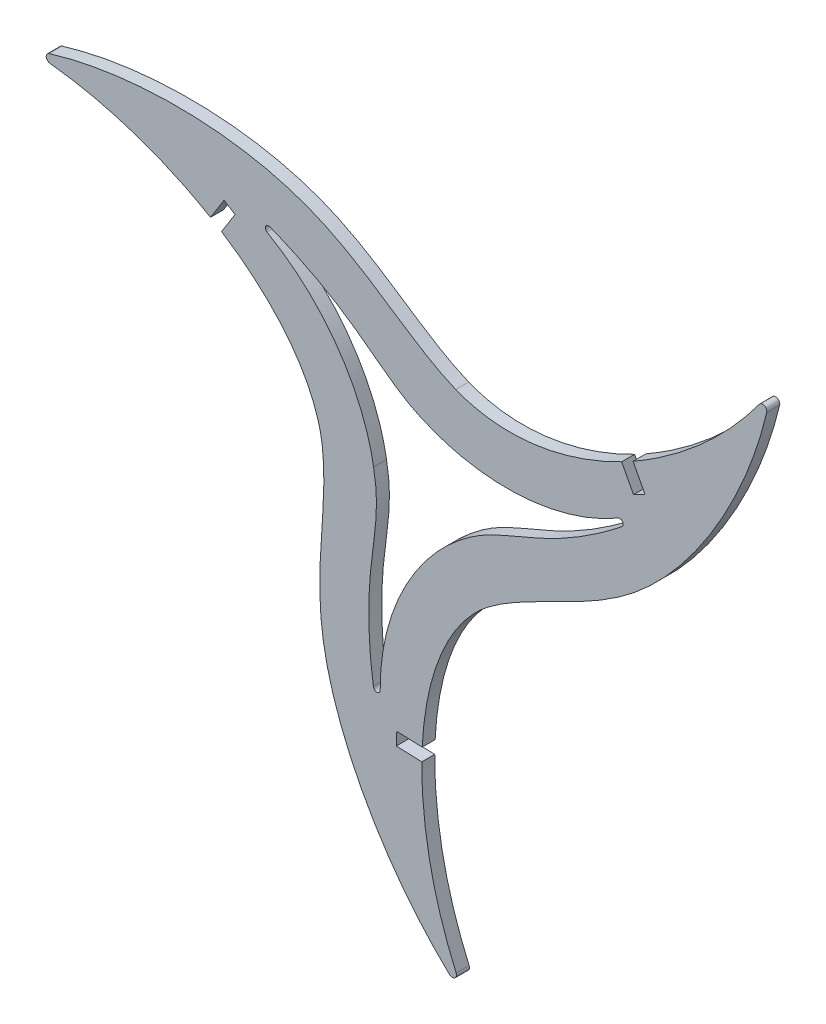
SolidWorks part; units mm, degrees
ref_plane "Ebene vorne" through (0, 0, 0) normal (0, 0, 1) x (1, 0, 0)
ref_plane "Ebene oben" through (0, 0, 0) normal (0, 1, 0) x (1, 0, 0)
ref_plane "Ebene rechts" through (0, 0, 0) normal (1, 0, 0) x (0, 0, -1)
sketch "Skizze1" plane through (0, 0, 0) normal (0, 0, 1) x (1, 0, 0)
  line L0 (43.1902, 33.0117) -> (46.1063, 27.4758)
  line L1 (40.3937, 31.5079) -> (43.2972, 25.9961)
  line L2 (43.2972, 25.9961) -> (46.1063, 27.4758)
  line L3 (-8.5062, -53.5215) -> (-14.7313, -53.2801)
  line L4 (-8.6021, -56.6952) -> (-14.8544, -56.4527)
  line L5 (-14.7313, -53.2801) -> (-14.8544, -56.4527)
  line L6 (-60.3944, 33.0117) -> (-57.0583, 38.305)
  line L7 (-57.6938, 31.3418) -> (-54.3722, 36.6122)
  line L8 (-57.0583, 38.305) -> (-54.3722, 36.6122)
  spline S1 degree 2 poles (-8.6021, -56.6952) (-8.7104, -77.8889) (-0.1875, -97.2936) knots 0 0 0 1.644334 1.644334 1.644334 weights 1 0.978139 1
  spline S2 degree 2 poles (-0.1875, -97.2936) (0.1477, -98.0529) (-0.5295, -98.5328) knots 0 0 0 0.054798 0.054798 0.054798 weights 1 0.774431 1
  spline S3 degree 2 poles (-0.5295, -98.5328) (-1.2067, -99.0127) (-1.8121, -98.4449) knots 0 0 0 0.054798 0.054798 0.054798 weights 1 0.774431 1
  spline S4 degree 3 poles (-1.8121, -98.4449) (-17.5303, -83.7006) (-39.8556, -44.1038) (-31.3931, -13.8158) (-33.0364, -1.3894) knots -21.515005 -21.515005 -21.515005 -21.515005 -19.059512 -17.06308 -17.06308 -17.06308 -17.06308
  spline S5 degree 3 poles (-33.0364, -1.3894) (-34.8893, 11.3259) (-44.451, 22.8058) (-57.6938, 31.3418) knots -17.06308 -17.06308 -17.06308 -17.06308 -16.564364 -16.564364 -16.564364 -16.564364
  spline S9 degree 2 poles (-60.3944, 33.0117) (-78.6945, 43.7023) (-99.761, 46.0236) knots 0 0 0 1.644334 1.644334 1.644334 weights 1 0.978139 1
  spline S10 degree 2 poles (-99.761, 46.0236) (-100.5861, 46.113) (-100.6632, 46.9394) knots 0 0 0 0.054798 0.054798 0.054798 weights 1 0.774431 1
  spline S11 degree 2 poles (-100.6632, 46.9394) (-100.7402, 47.7658) (-99.9457, 48.0062) knots 0 0 0 0.054798 0.054798 0.054798 weights 1 0.774431 1
  spline S12 degree 3 poles (-99.9457, 48.0062) (-79.3177, 54.2464) (-33.8631, 53.7823) (-11.8642, 31.3096) (-0.281, 26.5195) knots -15.419591 -15.419591 -15.419591 -15.419591 -12.964099 -10.967667 -10.967667 -10.967667 -10.967667
  spline S13 degree 3 poles (-0.281, 26.5195) (11.6572, 21.7665) (26.3799, 24.3072) (40.3937, 31.5079) knots -10.967667 -10.967667 -10.967667 -10.967667 -10.468951 -10.468951 -10.468951 -10.468951
  spline S17 degree 2 poles (43.1902, 33.0117) (61.5986, 43.5147) (74.1421, 60.5982) knots 0 0 0 1.644334 1.644334 1.644334 weights 1 0.978139 1
  spline S18 degree 2 poles (74.1421, 60.5982) (74.6321, 61.2681) (75.3863, 60.9216) knots 0 0 0 0.054798 0.054798 0.054798 weights 1 0.774431 1
  spline S19 degree 2 poles (75.3863, 60.9216) (76.1405, 60.5751) (75.9514, 59.7669) knots 0 0 0 0.054798 0.054798 0.054798 weights 1 0.774431 1
  spline S20 degree 3 poles (75.9514, 59.7669) (71.0416, 38.7824) (47.9124, -0.3504) (17.451, -8.1656) (7.5111, -15.802) knots -9.324178 -9.324178 -9.324178 -9.324178 -6.868686 -4.872254 -4.872254 -4.872254 -4.872254
  spline S21 degree 3 poles (7.5111, -15.802) (-2.5742, -23.7643) (-7.7352, -37.7848) (-8.5062, -53.5215) knots -4.872254 -4.872254 -4.872254 -4.872254 -4.373538 -4.373538 -4.373538 -4.373538
  spline S24 degree 3 poles (-5.3856, 14.8993) (-6.3705, 15.2781) (-19.1873, 20.1388) (-23.4723, 29.347) (-45.6826, 38.2193) knots 6.974314 6.974314 6.974314 6.974314 7.055112 8.055112 8.055112 8.055112 8.055112
  spline S25 degree 5 poles (-45.6826, 38.2193) (-45.8689, 38.2937) (-46.8468, 38.6839) (-47.5744, 37.6554) (-46.7041, 36.8862) (-46.5693, 36.809) knots -1 -1 -1 -1 -1 -1 0 0 0 0 0 0
  spline S26 degree 3 poles (-46.5693, 36.809) (-38.4192, 32.1417) (-26.3467, 19.6405) (-21.4452, 6.0758) (-20.4207, 0) knots 0 0 0 0 0.468786 0.937573 0.937573 0.937573 0.937573
  spline S27 degree 3 poles (-20.4207, 0) (-20.2563, -1.0424) (-18.0575, -14.5723) (-23.8895, -22.8874) (-20.4679, -46.5582) knots 0.937573 0.937573 0.937573 0.937573 1.018371 2.018371 2.018371 2.018371 2.018371
  spline S28 degree 5 poles (-20.4679, -46.5582) (-20.4392, -46.7567) (-20.2882, -47.7987) (-19.0337, -47.9146) (-18.8027, -46.7763) (-18.8033, -46.621) knots 2.018371 2.018371 2.018371 2.018371 2.018371 2.018371 3.018371 3.018371 3.018371 3.018371 3.018371 3.018371
  spline S29 degree 3 poles (-18.8033, -46.621) (-18.8363, -37.2292) (-14.0461, -20.5234) (-4.7496, -9.4963) (0, -5.5711) knots 3.018371 3.018371 3.018371 3.018371 3.487157 3.955943 3.955943 3.955943 3.955943
  spline S30 degree 3 poles (0, -5.5711) (0.8205, -4.9076) (11.4384, 3.7617) (21.5554, 2.8685) (40.3442, 17.6671) knots 3.955943 3.955943 3.955943 3.955943 4.036741 5.036741 5.036741 5.036741 5.036741
  spline S31 degree 5 poles (40.3442, 17.6671) (40.5018, 17.7912) (41.3287, 18.443) (40.8017, 19.5873) (39.7004, 19.2183) (39.5663, 19.1402) knots 5.036741 5.036741 5.036741 5.036741 5.036741 5.036741 6.036741 6.036741 6.036741 6.036741 6.036741 6.036741
  spline S32 degree 3 poles (39.5663, 19.1402) (31.4492, 14.4156) (14.5865, 10.2111) (0.3885, 12.7486) (-5.3856, 14.8993) knots 6.036741 6.036741 6.036741 6.036741 6.505527 6.974314 6.974314 6.974314 6.974314
extrude "Aufsatz-Linear austragen1" add sketch "Skizze1" along normal mid plane 3.175
ref_plane "Ebene1" through (46.0164, 24.2403, 0) normal (0.8848, 0.4661, 0) x (0, 0, -1)
ref_plane "Ebene2" through (-2.1467, -55.3568, 0) normal (0.0388, 0.9992, 0) x (-0.9992, 0.0388, 0)
ref_plane "Ebene3" through (-56.7728, 35.7806, 0) normal (-0.846, 0.5332, 0) x (0, 0, 1)
